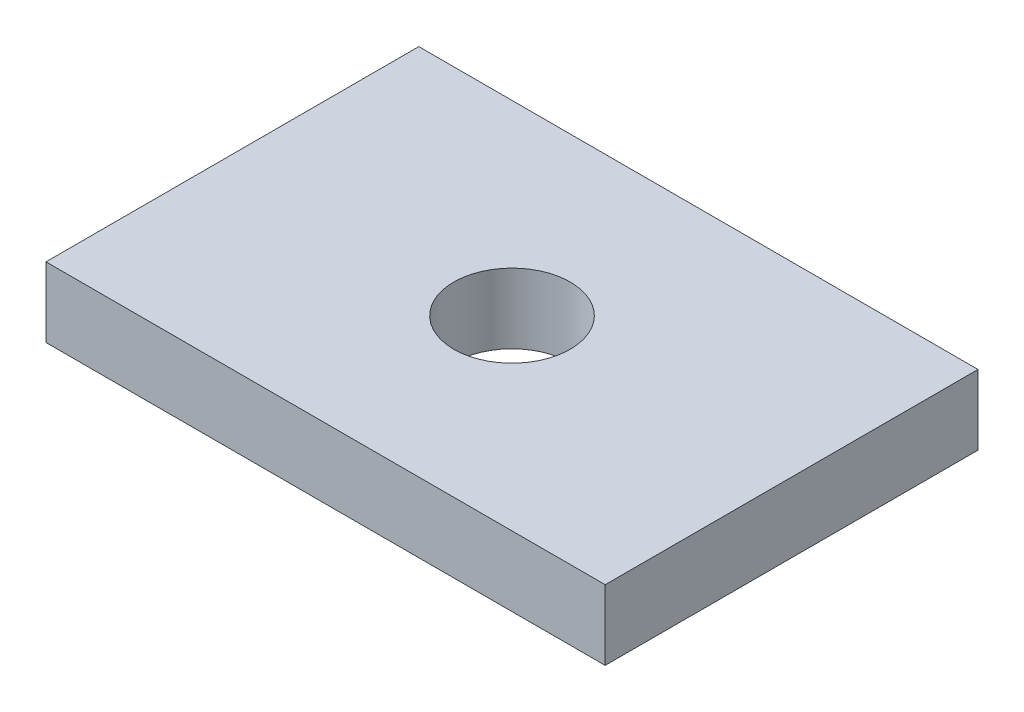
SolidWorks part; units mm, degrees
ref_plane "前视基准面" through (0, 0, 0) normal (0, 0, 1) x (1, 0, 0)
ref_plane "上视基准面" through (0, 0, 0) normal (0, 1, 0) x (1, 0, 0)
ref_plane "右视基准面" through (0, 0, 0) normal (1, 0, 0) x (0, 0, -1)
other "Configuration Table"
sketch "草图1" plane through (0, 0, 0) normal (0, 1, 0) x (1, 0, 0)
  line L1 (0, 0) -> (120, 0)
  line L2 (0, 0) -> (0, 80)
  line L3 (0, 80) -> (120, 80)
  line L4 (120, 0) -> (120, 80)
  dimension "D1" = 120
  dimension "D2" = 120
extrude "凸台-拉伸1" add sketch "草图1" against normal blind 15
sketch "草图2" plane through (0, 0, 0) normal (0, 1, 0) x (1, 0, 0)
  circle A0 centre (60, 40) radius 12.5
extrude "切除-拉伸1" cut sketch "草图2" against normal blind 15
